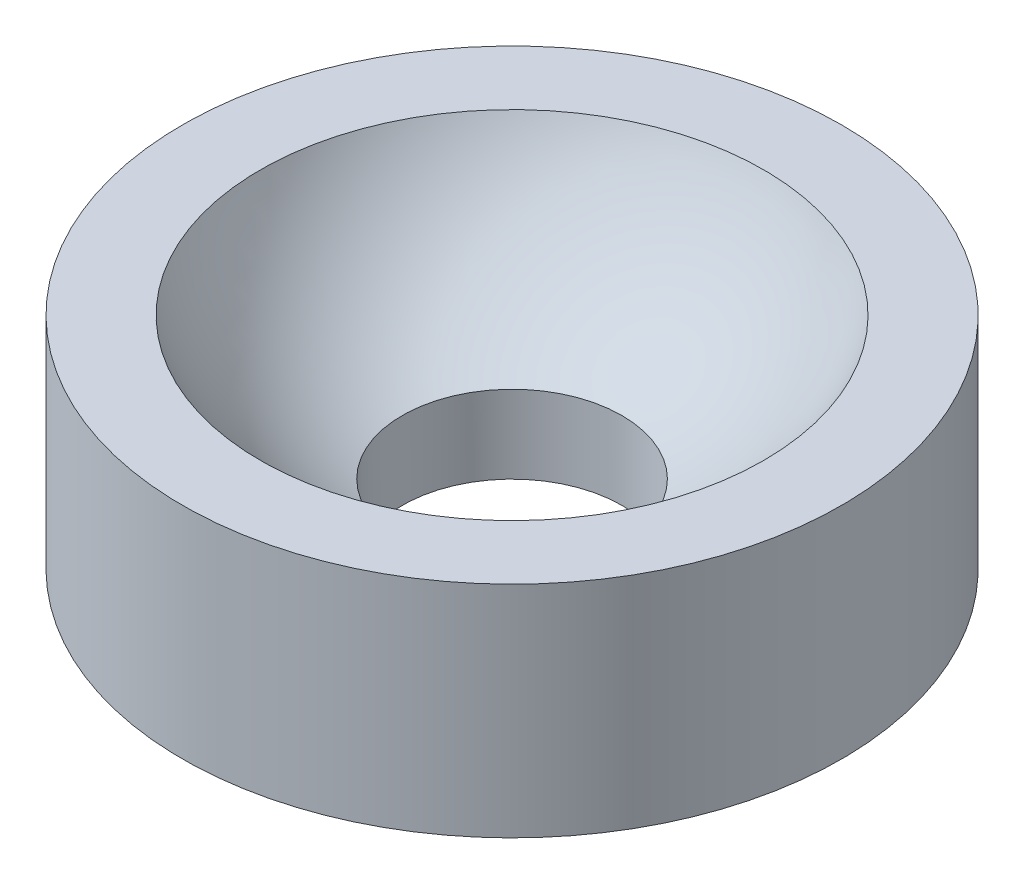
SolidWorks part; units mm, degrees
ref_plane "Płaszczyzna przednia" through (0, 0, 0) normal (0, 0, 1) x (1, 0, 0)
ref_plane "Płaszczyzna górna" through (0, 0, 0) normal (0, 1, 0) x (1, 0, 0)
ref_plane "Płaszczyzna prawa" through (0, 0, 0) normal (1, 0, 0) x (0, 0, -1)
sketch "Szkic1" plane through (0, 0, 0) normal (0, 0, 1) x (1, 0, 0)
  line L0 (0, 0) -> (6, 0)
  line L1 (6, 0) -> (6, 4)
  line L2 (6, 4) -> (4.5826, 4)
  line L3 (0, 0) -> (0, 1)
  line L4 (0, 1) -> (3.966, 1) construction
  arc A0 (4.5826, 4) -> (0, 1) centre (0, 6) cw
  dimension "D3" = 5
  dimension "D1" = 6
  dimension "D2" = 4
  dimension "D4" = 1
revolve "Obrót1" add sketch "Szkic1" angle 360 about L3
sketch "Szkic2" plane through (0, 0, 0) normal (0, -1, 0) x (1, 0, 0)
  circle A0 centre (0, 0) radius 2
  dimension "D1" = 4
extrude "Wytnij-wyciągnięcie1" cut sketch "Szkic2" against normal blind 10
